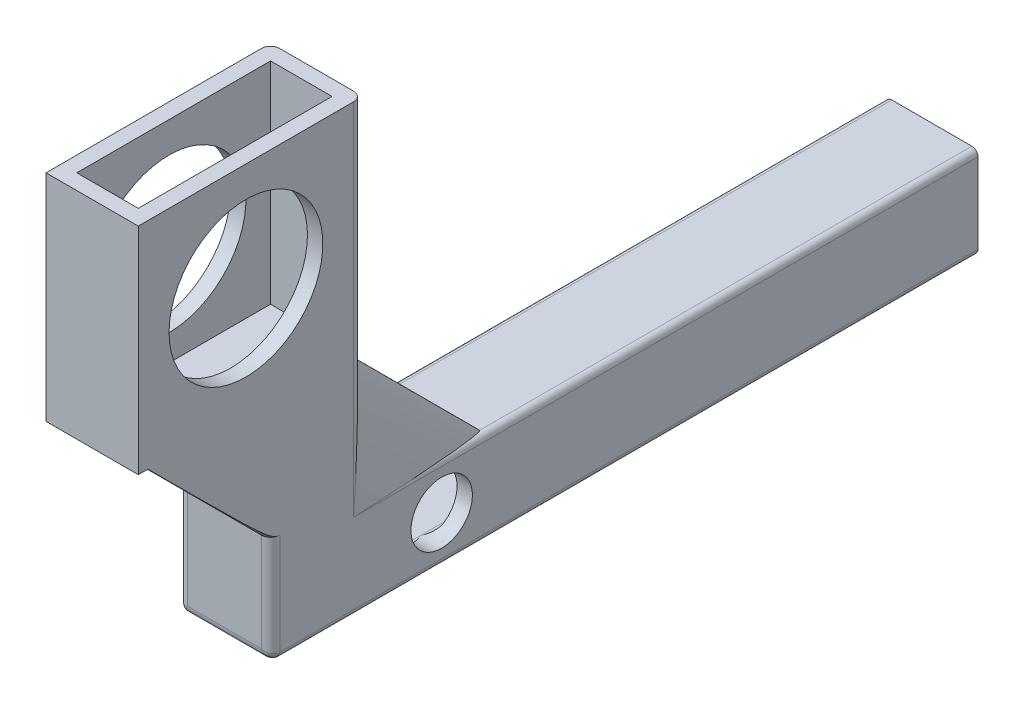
SolidWorks part; units mm, degrees
ref_plane "Plan de face" through (0, 0, 0) normal (0, 0, 1) x (1, 0, 0)
ref_plane "Plan de dessus" through (0, 0, 0) normal (0, 1, 0) x (1, 0, 0)
ref_plane "Plan de droite" through (0, 0, 0) normal (1, 0, 0) x (0, 0, -1)
sketch "Esquisse1" plane through (0, 0, 0) normal (0, 0, 1) x (1, 0, 0)
  line L1 (13, -15) -> (-13, -15)
  line L2 (15, -13) -> (15, 13)
  line L3 (13, 15) -> (-13, 15)
  line L4 (-15, -13) -> (-15, 13)
  line L5 (15, -15) -> (-15, 15) construction
  line L6 (15, 15) -> (-15, -15) construction
  line L7 (8, 10) -> (-8, 10)
  line L8 (10, 8) -> (10, -8)
  line L9 (8, -10) -> (-8, -10)
  line L10 (-10, 8) -> (-10, -8)
  line L11 (10, 10) -> (-10, -10) construction
  line L12 (10, -10) -> (-10, 10) construction
  arc A0 (-13, 15) -> (-15, 13) centre (-13, 13) ccw
  arc A1 (15, 13) -> (13, 15) centre (13, 13) ccw
  arc A2 (13, -15) -> (15, -13) centre (13, -13) ccw
  arc A3 (-13, -15) -> (-15, -13) centre (-13, -13) cw
  arc A4 (-8, -10) -> (-10, -8) centre (-8, -8) cw
  arc A5 (10, -8) -> (8, -10) centre (8, -8) cw
  arc A6 (8, 10) -> (10, 8) centre (8, 8) cw
  arc A7 (-8, 10) -> (-10, 8) centre (-8, 8) ccw
  point P0 (0, 0)
  point P6 (0, 0)
  dimension "D6" = 2
  dimension "D7" = 2
  dimension "D1" = 30
  dimension "D2" = 30
  dimension "D3" = 5
  dimension "D4" = 5
  dimension "D5" = 5
extrude "Boss.-Extru.1" add sketch "Esquisse1" along normal blind 200
sketch "Esquisse2" plane through (0, 0, 200) normal (0, 0, 1) x (1, 0, 0)
  line L0 (-13, -15) -> (13, -15) construction
  line L2 (15, -13) -> (15, -10)
  line L3 (15, -10) -> (-15, -10)
  line L4 (-15, -13) -> (-15, -10)
  line L7 (-15, 13) -> (-15, -13) construction
  line L8 (-8, -10) -> (8, -10) construction
  line L9 (13, -15) -> (-13, -15)
  arc A0 (-13, -15) -> (-15, -13) centre (-13, -13) cw
  arc A1 (13, -15) -> (15, -13) centre (13, -13) ccw
  point P0 (0, -15)
  dimension "D2" = 2
  dimension "D1" = 0
extrude "Boss.-Extru.2" add sketch "Esquisse2" along normal blind 30
sketch "Esquisse3" plane through (0, -10, 0) normal (0, 1, 0) x (1, 0, 0)
  line L1 (-15, -200) -> (15, -200)
  line L2 (-15, -200) -> (-15, -230)
  line L3 (-15, -230) -> (15, -230)
  line L4 (15, -200) -> (15, -230)
extrude "Boss.-Extru.3" add sketch "Esquisse3" along normal blind 140
fillet "Congé1" radius 3 5 edges at (-15, 58.5, 230) (-14.4142, -14.4142, 230) (0, -15, 230) (14.4142, -14.4142, 230) (15, 58.5, 230)
fillet "Congé2" radius 3 2 edges at (-15, 71.5, 200) (15, 71.5, 200)
sketch "Esquisse4" plane through (0, 130, 0) normal (0, 1, 0) x (1, 0, 0)
  line L0 (-15, -215) -> (15, -215)
  line L1 (-15, -203) -> (-15, -227) construction
  line L2 (15, -227) -> (15, -203) construction
  line L3 (15, -215) -> (0, -200)
  line L4 (12, -200) -> (-12, -200) construction
  line L5 (0, -200) -> (0, -215)
  line L6 (-12, -230) -> (12, -230) construction
  line L7 (8, -225) -> (-8, -225)
  line L8 (10, -223) -> (10, -207)
  line L9 (8, -205) -> (-8, -205)
  line L10 (-10, -223) -> (-10, -207)
  line L11 (10, -225) -> (-10, -205) construction
  line L12 (10, -205) -> (-10, -225) construction
  arc A0 (10, -207) -> (8, -205) centre (8, -207) ccw
  arc A1 (8, -225) -> (10, -223) centre (8, -223) ccw
  arc A2 (-8, -225) -> (-10, -223) centre (-8, -223) cw
  arc A3 (-8, -205) -> (-10, -207) centre (-8, -207) ccw
  dimension "D3" = 2
  dimension "D1" = 5
  dimension "D2" = 5
extrude "Enlèv. mat.-Extru.1" cut sketch "Esquisse4" against normal blind 140 contours A2 L7 A1 L8 L0 L10 | L9 A3 L10 L0 L5 | L3 L9 L5 L0 L8 | L8 A0 L9 L3
sketch "Esquisse5" plane through (15, 0, 0) normal (1, 0, 0) x (0, 0, -1)
  line L0 (-174.3695, 13) -> (-174.3695, 10)
  line L1 (-203, 13) -> (0, 13) construction
  line L2 (-227, -13) -> (0, -13) construction
  line L3 (-174.3695, -10) -> (-174.3695, -13)
  circle A0 centre (-174.3695, 0) radius 10
  dimension "D1" = 20
extrude "Enlèv. mat.-Extru.2" cut sketch "Esquisse5" against normal blind 57 contours A0
sketch "Esquisse6" plane through (-15, 0, 0) normal (-1, 0, 0) x (0, 0, 1)
  line L0 (203, 130) -> (227, 130) construction
  circle A0 centre (215, 96.81) radius 10
  dimension "D1" = 20
  dimension "D2" = 33.19
extrude "Enlèv. mat.-Extru.3" cut sketch "Esquisse6" against normal blind 41
sketch "Esquisse7" plane through (-15, 0, 0) normal (-1, 0, 0) x (0, 0, 1)
  line L1 (203, 130) -> (273, 130)
  line L2 (203, 130) -> (203, 60)
  line L3 (203, 60) -> (273, 60)
  line L4 (273, 130) -> (273, 60)
  dimension "D1" = 70
  dimension "D2" = 70
extrude "Boss.-Extru.4" add sketch "Esquisse7" against normal blind 30
sketch "Esquisse8" plane through (-15, 0, 0) normal (-1, 0, 0) x (0, 0, 1)
  line L1 (203, 130) -> (273, 130) construction
  line L3 (273, 60) -> (273, 130) construction
  circle A0 centre (238, 95) radius 25
  dimension "D1" = 50
  dimension "D2" = 10
  dimension "D3" = 10
extrude "Enlèv. mat.-Extru.4" cut sketch "Esquisse8" against normal blind 30
chamfer "Chanfrein1" distance 40 angle 45 3 edges at (-14.1213, 60, 229.1213) (14.1213, 60, 229.1213) (0, 60, 230)
chamfer "Chanfrein2" distance 40 angle 45 5 edges at (14.2403, 14.569, 201.0047) (-14.2403, 14.569, 201.0047) (12.5073, 15, 200.0432) (-12.5073, 15, 200.0432) (0, 15, 200)
sketch "Esquisse9" plane through (0, 130, 0) normal (0, 1, 0) x (1, 0, 0)
  line L0 (12, -200) -> (-12, -200) construction
  line L1 (10, -205) -> (-10, -205)
  line L2 (10, -205) -> (10, -268)
  line L3 (10, -268) -> (-10, -268)
  line L4 (-10, -205) -> (-10, -268)
  line L5 (15, -273) -> (-15, -273) construction
  line L6 (15, -273) -> (15, -203) construction
  line L7 (-15, -203) -> (-15, -273) construction
  dimension "D1" = 5
  dimension "D2" = 5
  dimension "D3" = 5
  dimension "D4" = 5
extrude "Enlèv. mat.-Extru.5" cut sketch "Esquisse9" against normal blind 1
sketch "Esquisse12" plane through (0, 129, 0) normal (0, 1, 0) x (1, 0, 0)
  line L1 (10, -205) -> (-10, -205)
  line L2 (10, -205) -> (10, -268)
  line L3 (10, -268) -> (-10, -268)
  line L4 (-10, -205) -> (-10, -268)
extrude "Enlèv. mat.-Extru.8" cut sketch "Esquisse12" against normal blind 67.5
ref_plane "Plan1" through (0, 0, 0) normal (1, 0, 0) x (0, 0, -1)
